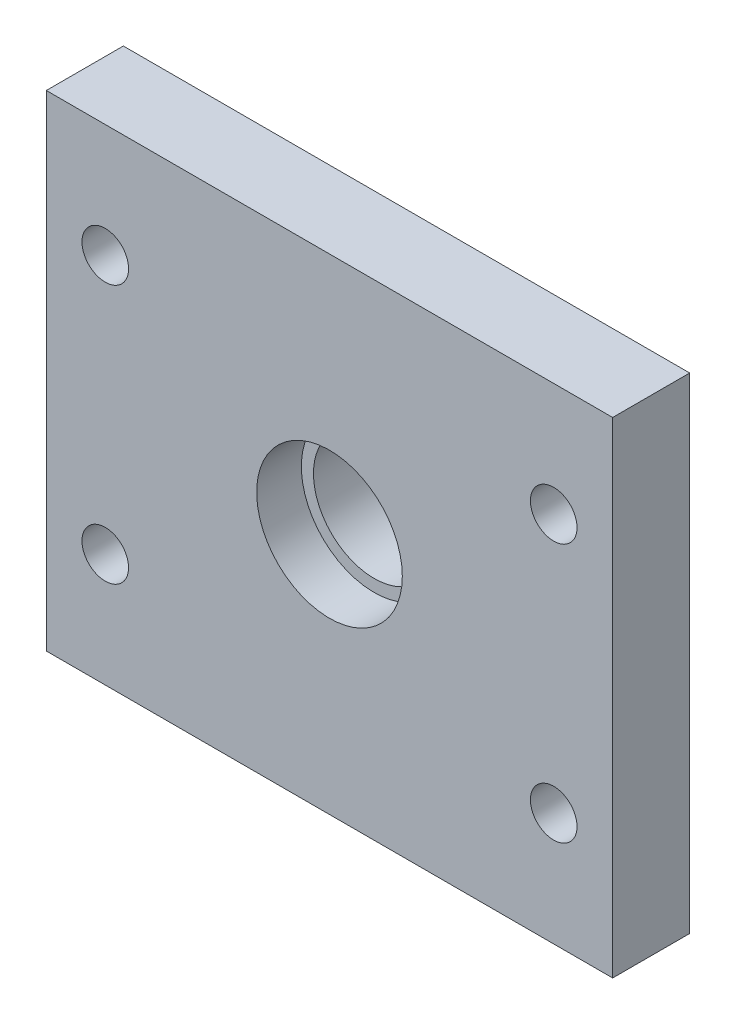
SolidWorks part; units mm, degrees
ref_plane "Front Plane" through (0, 0, 0) normal (0, 0, 1) x (1, 0, 0)
ref_plane "Top Plane" through (0, 0, 0) normal (0, 1, 0) x (1, 0, 0)
ref_plane "Right Plane" through (0, 0, 0) normal (1, 0, 0) x (0, 0, -1)
sketch "Sketch1" plane through (0, 0, 0) normal (0, 0, 1) x (1, 0, 0)
  line L1 (0, 0) -> (44.45, 0)
  line L2 (0, 0) -> (0, 38.1)
  line L3 (0, 38.1) -> (44.45, 38.1)
  line L4 (44.45, 0) -> (44.45, 38.1)
  dimension "D1" = 38.1
  dimension "D2" = 44.45
extrude "Extrude1" add sketch "Sketch1" along normal blind 6.0452
sketch "Sketch2" plane through (0, 0, 6.0452) normal (0, 0, 1) x (1, 0, 0)
  line L0 (44.45, 0) -> (44.45, 38.1) construction
  line L1 (44.45, 38.1) -> (0, 38.1) construction
  circle A0 centre (22.225, 19.05) radius 2.3495
  dimension "D1" = 4.699
  dimension "D2" = 22.225
  dimension "D3" = 19.05
sketch "Sketch4" plane through (0, 0, 6.0452) normal (0, 0, 1) x (1, 0, 0)
  line L0 (22.225, 19.05) -> (0.6859, 19.05) construction
  line L1 (22.225, 19.05) -> (4.6274, 8.89) construction
  circle A0 centre (4.6274, 8.89) radius 1.8288
  dimension "D3" = 3.6576
  dimension "D1" = 20.32
  dimension "D2" = 30
sketch "Sketch6" plane through (0, 0, 6.0452) normal (0, 0, 1) x (1, 0, 0)
  circle A0 centre (4.6274, 8.89) radius 1.8288
extrude "Cut-Extrude3" cut sketch "Sketch6" against normal through all
sketch "Sketch7" plane through (0, 0, 6.0452) normal (0, 0, 1) x (1, 0, 0)
  line L0 (22.225, 19.05) -> (4.6274, 29.21) construction
  line L1 (22.225, 19.05) -> (0.6859, 19.05) construction
  line L2 (22.225, 19.05) -> (41.9056, 19.05) construction
  line L3 (22.225, 19.05) -> (39.8226, 29.21) construction
  line L4 (22.225, 19.05) -> (39.8226, 8.89) construction
  circle A0 centre (4.6274, 29.21) radius 1.8288
  circle A1 centre (39.8226, 29.21) radius 1.8288
  circle A2 centre (39.8226, 8.89) radius 1.8288
  dimension "D1" = 3.6576
  dimension "D4" = 3.6576
  dimension "D6" = 3.6576
  dimension "D2" = 20.32
  dimension "D3" = 30
  dimension "D5" = 20.32
  dimension "D7" = 20.32
  dimension "D8" = 30
  dimension "D9" = 30
extrude "Cut-Extrude4" cut sketch "Sketch7" against normal through all
sketch "Sketch8" plane through (0, 0, 0) normal (0, 0, -1) x (-1, 0, 0)
  line L1 (-28.575, 25.4) -> (-15.875, 25.4)
  line L2 (-28.575, 25.4) -> (-28.575, 12.7)
  line L3 (-28.575, 12.7) -> (-15.875, 12.7)
  line L4 (-15.875, 25.4) -> (-15.875, 12.7)
  dimension "D1" = 12.7
  dimension "D2" = 12.7
  dimension "D3" = 6.35
  dimension "D4" = 6.35
extrude "Extrude2" add sketch "Sketch8" along normal blind 9.525
sketch "Sketch5" plane through (0, 0, 6.0452) normal (0, 0, 1) x (1, 0, 0)
  circle A0 centre (22.225, 19.05) radius 2.3495
extrude "Cut-Extrude2" cut sketch "Sketch5" against normal through all
sketch "Sketch9" plane through (0, 0, 6.0452) normal (0, 0, 1) x (1, 0, 0)
  circle A0 centre (22.225, 19.05) radius 4.7625
  dimension "D1" = 9.525
extrude "Cut-Extrude5" cut sketch "Sketch9" against normal blind 10.16
sketch "Sketch10" plane through (0, 0, 6.0452) normal (0, 0, 1) x (1, 0, 0)
  circle A0 centre (22.225, 19.05) radius 5.715
  dimension "D1" = 11.43
extrude "Cut-Extrude7" cut sketch "Sketch10" against normal blind 3.5052
